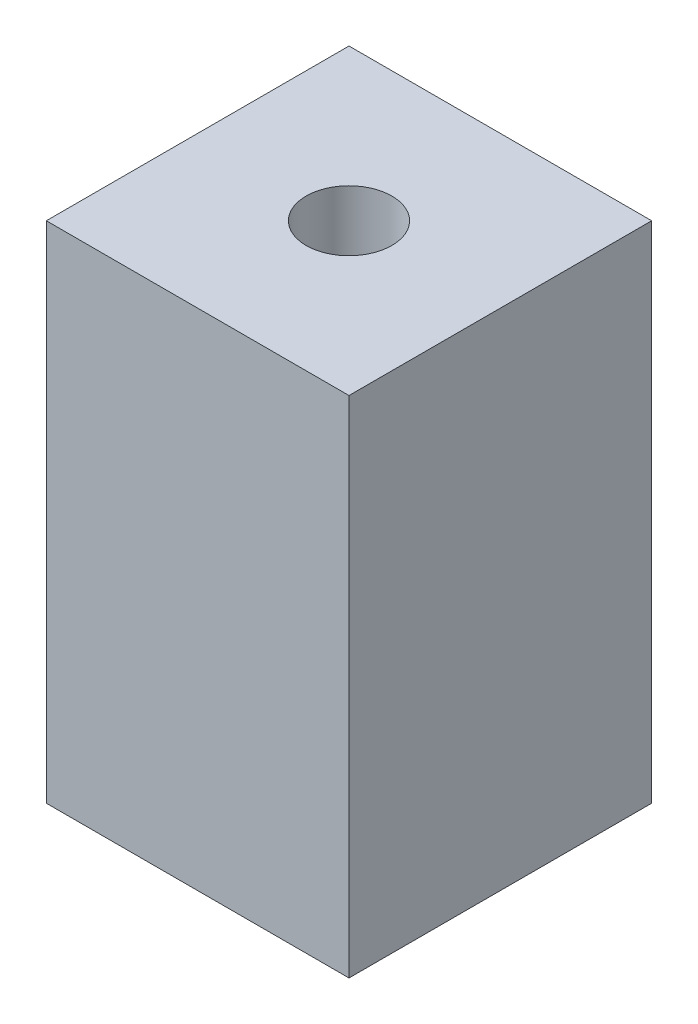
SolidWorks part; units mm, degrees
ref_plane "Front Plane" through (0, 0, 0) normal (0, 0, 1) x (1, 0, 0)
ref_plane "Top Plane" through (0, 0, 0) normal (0, 1, 0) x (1, 0, 0)
ref_plane "Right Plane" through (0, 0, 0) normal (1, 0, 0) x (0, 0, -1)
sketch "Sketch1" plane through (0, 0, 0) normal (0, 1, 0) x (1, 0, 0)
  line L1 (-15, 15) -> (15, 15)
  line L2 (-15, 15) -> (-15, -15)
  line L3 (-15, -15) -> (15, -15)
  line L4 (15, 15) -> (15, -15)
  line L5 (-15, 15) -> (15, -15) construction
  line L6 (-15, -15) -> (15, 15) construction
  point P0 (0, 0)
  dimension "D1" = 30
  dimension "D2" = 30
extrude "Boss-Extrude1" add sketch "Sketch1" along normal blind 50
hole_wizard "M10 Tapped Hole1" positions "Sketch3" profile "Sketch2" tap size "M10" standard "DIN"
sketch "Sketch3" plane through (0, 50, 0) normal (0, 1, 0) x (1, 0, 0)
  line L0 (-55, 0) -> (55, 0) construction
  line L1 (0, -55) -> (0, 55) construction
  point P0 (0, 0)
sketch "Sketch2" plane through (0, 50, 0) normal (1, 0, 0) x (0, 0, 1)
  line L0 (0, 0) -> (0, 34.8537)
  line L1 (0, 34.8537) -> (4.25, 32.3)
  line L2 (4.25, 32.3) -> (4.25, 0)
  line L5 (4.25, 0) -> (0, 0)
  line L10 (0, 34.8537) -> (-4.25, 32.3) construction
  line L11 (0, -6.35) -> (0, 107.95) construction
  dimension "Tap Drill Dia." = 8.5
  dimension "Tap Drill Depth" = 32.3
  dimension "Drill Angle" = 118
